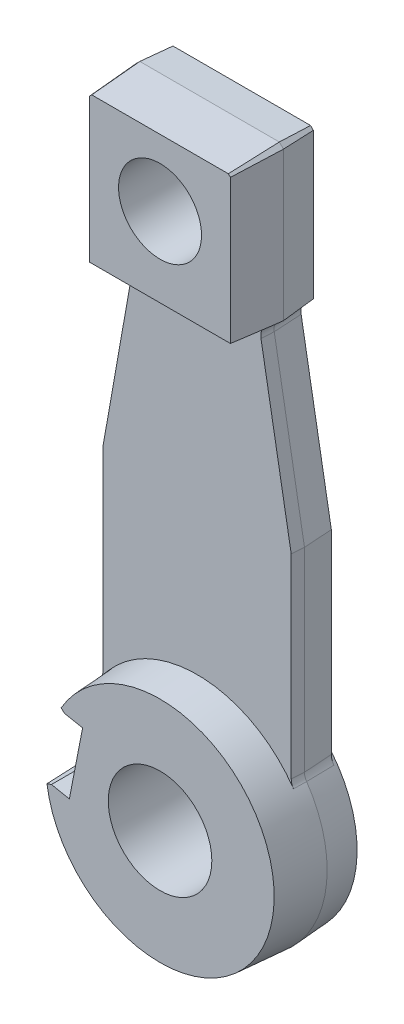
SolidWorks part; units mm, degrees
ref_plane "Plan1" through (0, 0, 0) normal (0, 0, 1) x (1, 0, 0)
ref_plane "Plan2" through (0, 0, 0) normal (0, 1, 0) x (1, 0, 0)
ref_plane "Plan3" through (0, 0, 0) normal (1, 0, 0) x (0, 0, -1)
sketch "Esquisse1" plane through (0, 0, 0) normal (0, 0, 1) x (1, 0, 0)
  line L0 (-54.7, 0) -> (62.9, 0) construction
  line L1 (0, 163.2) -> (0, -34.6) construction
  line L2 (-23, 17.7834) -> (-23, 65)
  line L3 (23, 17.7834) -> (23, 65)
  line L4 (-27.3, 130) -> (21.2, 130) construction
  line L6 (-16.9, 147) -> (16.9, 147)
  line L7 (-17.9, 146) -> (-17.9, 110)
  line L9 (17.9, 146) -> (17.9, 110)
  line L11 (-15.6704, 106.5679) -> (-23, 65)
  line L12 (15.6704, 106.5679) -> (23, 65)
  line L16 (-17.9, 146) -> (-16.9, 147)
  line L17 (17.9, 146) -> (16.9, 147)
  arc A0 (-23.5238, 16.0898) -> (23.5238, 16.0898) centre (0, 0) ccw
  arc A1 (-17.9, 110) -> (-15.6704, 106.5679) centre (-18.6249, 107.0889) cw
  arc A2 (17.9, 110) -> (15.6704, 106.5679) centre (18.6249, 107.0889) ccw
  arc A3 (-23.5238, 16.0898) -> (-23, 17.7834) centre (-26, 17.7834) ccw
  arc A4 (23.5238, 16.0898) -> (23, 17.7834) centre (26, 17.7834) cw
  dimension "D1" = 28.5
  dimension "D7" = 3
  dimension "D10" = 3
  dimension "D11" = 3
  dimension "D2" = 130
  dimension "D3" = 35.8
  dimension "D4" = 20
  dimension "D5" = 17
  dimension "D6" = 46
  dimension "D8" = 10
  dimension "D9" = 10
  dimension "D20" = 65
  dimension "D21" = 45
  dimension "D22" = 1
extrude "Base-Extrusion" add sketch "Esquisse1" against normal blind 7 draft 4
sketch "Esquisse2" plane through (0, 0, 0) normal (0, 0, 1) x (1, 0, 0)
  line L12 (-23, 65) -> (-23, 17.7834)
  line L13 (-15.6704, 106.5679) -> (-23, 65)
  line L14 (-17.9, 146) -> (-17.9, 110)
  line L15 (16.9, 147) -> (-16.9, 147)
  line L16 (17.9, 110) -> (17.9, 146)
  line L17 (23, 65) -> (15.6704, 106.5679)
  line L18 (23, 17.7834) -> (23, 65)
  line L24 (-23, 65) -> (-23, 17.7834)
  line L25 (-15.6704, 106.5679) -> (-23, 65)
  line L26 (-17.9, 146) -> (-17.9, 110)
  line L27 (16.9, 147) -> (-16.9, 147)
  line L28 (17.9, 110) -> (17.9, 146)
  line L29 (23, 65) -> (15.6704, 106.5679)
  line L30 (23, 17.7834) -> (23, 65)
  line L38 (-16.9, 147) -> (-17.9, 146)
  line L39 (-16.9, 147) -> (-17.9, 146)
  line L40 (17.9, 146) -> (16.9, 147)
  line L41 (17.9, 146) -> (16.9, 147)
  arc A8 (-23.5238, 16.0898) -> (-23, 17.7834) centre (-26, 17.7834) ccw
  arc A9 (-15.6704, 106.5679) -> (-17.9, 110) centre (-18.6249, 107.0889) ccw
  arc A10 (17.9, 110) -> (15.6704, 106.5679) centre (18.6249, 107.0889) ccw
  arc A11 (23, 17.7834) -> (23.5238, 16.0898) centre (26, 17.7834) ccw
  arc A12 (-23.5238, 16.0898) -> (23.5238, 16.0898) centre (0, 0) ccw
  arc A13 (-23.5238, 16.0898) -> (23.5238, 16.0898) centre (0, 0) ccw
  arc A16 (-23.5238, 16.0898) -> (-23, 17.7834) centre (-26, 17.7834) ccw
  arc A17 (-15.6704, 106.5679) -> (-17.9, 110) centre (-18.6249, 107.0889) ccw
  arc A18 (17.9, 110) -> (15.6704, 106.5679) centre (18.6249, 107.0889) ccw
  arc A19 (23, 17.7834) -> (23.5238, 16.0898) centre (26, 17.7834) ccw
  dimension "D1" = 0
extrude "Boss.-Extru.1" add sketch "Esquisse2" along normal blind 3 draft 4
sketch "Esquisse3" plane through (0, 0, 3) normal (0, 0, 1) x (1, 0, 0)
  line L3 (-17.6902, 110.1596) -> (-17.6902, 145.9131) construction
  line L4 (-17.6902, 145.9131) -> (-16.8131, 146.7902) construction
  line L5 (-16.8131, 146.7902) -> (16.8131, 146.7902) construction
  line L6 (16.8131, 146.7902) -> (17.6902, 145.9131) construction
  line L7 (17.6902, 145.9131) -> (17.6902, 110.1596) construction
  line L8 (-17.6902, 110.1596) -> (-17.6902, 145.9131)
  line L9 (-17.6902, 145.9131) -> (-16.8131, 146.7902)
  line L10 (-16.8131, 146.7902) -> (16.8131, 146.7902)
  line L11 (16.8131, 146.7902) -> (17.6902, 145.9131)
  line L12 (17.6902, 145.9131) -> (17.6902, 110.1596)
  line L13 (17.6902, 110.1596) -> (-17.6902, 110.1596)
  circle A2 centre (0, 0) radius 28.2902
  arc A4 (-23.3507, 15.9713) -> (23.3507, 15.9713) centre (0, 0) ccw construction
extrude "Boss.-Extru.2" add sketch "Esquisse3" along normal blind 9 draft 4
sketch "Esquisse7" plane through (0, 0, -7) normal (0, 0, -1) x (-1, 0, 0)
  line L0 (17.4105, 145.7972) -> (17.4105, 110.3603) construction
  line L1 (16.6972, 146.5105) -> (17.4105, 145.7972) construction
  line L2 (-17.4105, 110.3603) -> (-17.4105, 145.7972) construction
  line L3 (-17.4105, 145.7972) -> (-16.6972, 146.5105) construction
  line L4 (-16.6972, 146.5105) -> (16.6972, 146.5105) construction
  line L5 (17.4105, 145.7972) -> (17.4105, 110.3603)
  line L6 (16.6972, 146.5105) -> (17.4105, 145.7972)
  line L7 (-17.4105, 110.3603) -> (-17.4105, 145.7972)
  line L8 (-17.4105, 145.7972) -> (-16.6972, 146.5105)
  line L9 (-16.6972, 146.5105) -> (16.6972, 146.5105)
  line L10 (17.4105, 110.3603) -> (-17.4105, 110.3603)
  circle A0 centre (0, 0) radius 28.0105
  arc A2 (-23.1198, 15.8134) -> (23.1198, 15.8134) centre (0, 0) ccw construction
extrude "Boss.-Extru.3" add sketch "Esquisse7" along normal blind 0.8 draft 4
sketch "Esquisse4" plane through (0, 0, 0) normal (0, 0, 1) x (1, 0, 0)
  line L0 (-39.4459, 7.6675) -> (0, 0) construction
  line L6 (0, 0) -> (0, 151.5) construction
  line L7 (-24.1, 130) -> (54.5, 130) construction
  line L8 (-45.9, 0) -> (59.4, 0) construction
  line L9 (16.9, 147) -> (-16.9, 147) construction
  line L10 (-18.766, 12.205) -> (-21.9716, -4.2864)
  line L11 (-18.766, 12.205) -> (-23.1079, 13.0489)
  line L12 (-23.1079, 13.0489) -> (-24.6173, 14.3611)
  line L13 (-26.3134, -3.4424) -> (-28.2045, -4.0935)
  line L14 (-21.9716, -4.2864) -> (-26.3134, -3.4424)
  circle A0 centre (0, 130) radius 10.05
  circle A3 centre (0, 0) radius 12.55
  arc A4 (-28.2045, -4.0935) -> (-24.6173, 14.3611) centre (0, 0) cw
  arc A5 (-23.5238, 16.0898) -> (23.5238, 16.0898) centre (0, 0) ccw construction
  dimension "D2" = 20.1
  dimension "D4" = 16.8
  dimension "D8" = 25.1
  dimension "D1" = 17
  dimension "D3" = 11
  dimension "D5" = 20.75
  dimension "D6" = 30
  dimension "D7" = 1
extrude "Enlèv. mat.-Extru.1" cut sketch "Esquisse4" against normal mid plane 50
